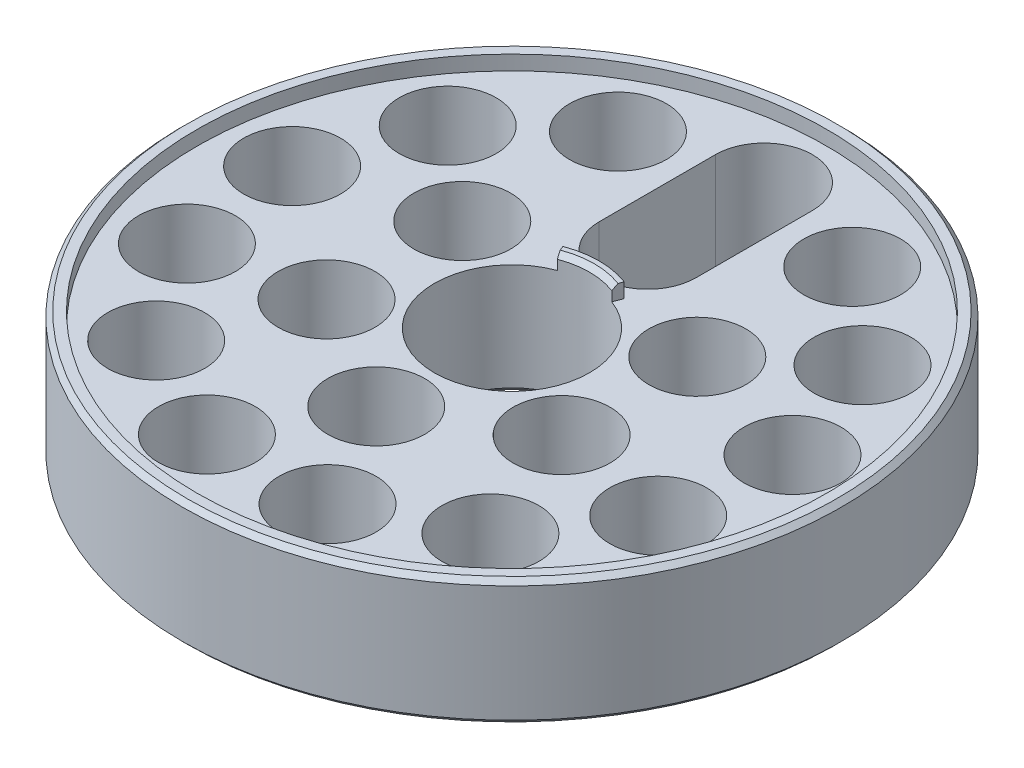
SolidWorks part; units mm, degrees
ref_plane "Front Plane" through (0, 0, 0) normal (0, 0, 1) x (1, 0, 0)
ref_plane "Top Plane" through (0, 0, 0) normal (0, 1, 0) x (1, 0, 0)
ref_plane "Right Plane" through (0, 0, 0) normal (1, 0, 0) x (0, 0, -1)
sketch "Sketch1" plane through (0, 0, 0) normal (0, 1, 0) x (1, 0, 0)
  circle A0 centre (0, 0) radius 8
  circle A1 centre (0, 0) radius 20 construction
  circle A2 centre (0, 0) radius 34
  circle A3 centre (0, 0) radius 14 construction
  circle A4 centre (0, 0) radius 26 construction
extrude "Boss-Extrude1" add sketch "Sketch1" against normal blind 13
sketch "Sketch2" plane through (0, 0, 0) normal (0, 1, 0) x (1, 0, 0)
  line L0 (0, 0) -> (0, 8) construction
  line L1 (0, 8) -> (3, 8) construction
  line L2 (3, 8) -> (2.809, 7.4906) construction
  line L3 (2.809, 7.4906) -> (3, 8)
  line L4 (3, 8) -> (3.1601, 8.427)
  line L5 (-2.809, 7.4906) -> (-3, 8)
  line L6 (-3, 8) -> (-3.1601, 8.427)
  arc A0 (-2.809, 7.4906) -> (2.809, 7.4906) centre (0, 0) ccw
  circle A1 centre (0, 0) radius 32.5
  arc A2 (3.1601, 8.427) -> (-3.1601, 8.427) centre (0, 0) ccw
extrude "Cut-Extrude1" cut sketch "Sketch2" against normal blind 1.5
chamfer "Chamfer1" distance 0.5 angle 45 4 edges at (0, 0, -8) (0, -13, 8) (0, -13, 34) (0, 0, 34)
sketch "Sketch3" plane through (0, -1.5, 0) normal (0, 1, 0) x (1, 0, 0)
  line L1 (-5, 26) -> (-5, 14)
  line L2 (5, 26) -> (5, 14)
  circle A0 centre (0, 0) radius 26 construction
  circle A1 centre (0, 0) radius 14 construction
  arc A2 (5, 26) -> (-5, 26) centre (0, 26) ccw
  circle A3 centre (12.0828, 23.0219) radius 5
  circle A4 centre (21.3976, 14.7697) radius 5
  circle A5 centre (25.8104, 3.134) radius 5
  circle A6 centre (24.3104, -9.2197) radius 5
  circle A7 centre (17.2412, -19.4613) radius 5
  circle A8 centre (6.2222, -25.2445) radius 5
  circle A9 centre (-6.2222, -25.2445) radius 5
  circle A10 centre (-17.2412, -19.4613) radius 5
  circle A11 centre (-24.3104, -9.2197) radius 5
  circle A12 centre (-25.8104, 3.134) radius 5
  circle A13 centre (-21.3976, 14.7697) radius 5
  circle A14 centre (-12.0828, 23.0219) radius 5
  arc A15 (-5, 14) -> (5, 14) centre (0, 14) ccw
  circle A16 centre (12.1244, 7) radius 5
  circle A17 centre (12.1244, -7) radius 5
  circle A18 centre (0, -14) radius 5
  circle A19 centre (-12.1244, -7) radius 5
  circle A20 centre (-12.1244, 7) radius 5
  point P0 (0, 26)
  point P1 (0, 14)
  point P34 (0, 0)
  point P47 (0, 0)
  dimension "D1" = 13
  dimension "D2" = 6
extrude "Cut-Extrude2" cut sketch "Sketch3" against normal blind 10
sketch "Sketch4" plane through (0, -11.5, 0) normal (0, 1, 0) x (1, 0, 0)
  circle A0 centre (0, 14) radius 5
  circle A1 centre (0, 0) radius 14 construction
extrude "Cut-Extrude3" cut sketch "Sketch4" against normal through all
